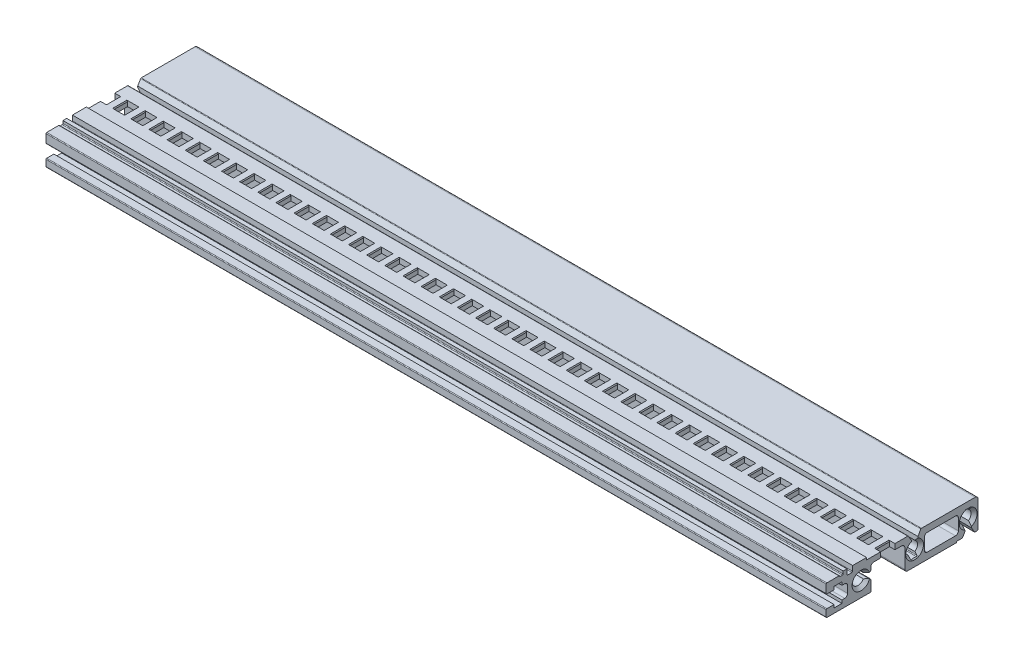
SolidWorks part; units mm, degrees
other "34566584"
ref_plane "前视基准面" through (0, 0, 0) normal (0, 0, 1) x (1, 0, 0)
ref_plane "上视基准面" through (0, 0, 0) normal (0, 1, 0) x (1, 0, 0)
ref_plane "右视基准面" through (0, 0, 0) normal (1, 0, 0) x (0, 0, -1)
imported_body "输入1"
sketch "草图1" plane through (0, 0, 0) normal (0, 1, 0) x (1, 0, 0)
  line L0 (-215.9, 9.4065) -> (-215.9, 24.45) construction
  line L1 (215.9, 41.3252) -> (2.54, 41.3252)
  line L2 (215.9, 41.3252) -> (215.9, -32.8369)
  line L3 (215.9, -32.8369) -> (2.54, -32.8369)
  line L4 (2.54, 41.3252) -> (2.54, -32.8369)
  line L5 (215.9, 24.45) -> (215.9, 9.4065) construction
  dimension "D1" = 218.44
extrude "切除-拉伸1" cut sketch "草图1" against normal mid plane 40
sketch "草图2" plane through (2.54, 0, 0) normal (1, 0, 0) x (0, 0, -1)
  circle A0 centre (-7.5, -4.2) radius 1.65
  circle A1 centre (7.5, -4.2) radius 1.65
  circle A2 centre (22.5, -4.2) radius 1.65
  dimension "D1" = 3.3
extrude "切除-拉伸2" cut sketch "草图2" against normal blind 15.02
chamfer "倒角1" distance 0.85 angle 45 4 edges at (2.54, -4.2, -24.15) (2.54, -4.2, -20.85) (2.54, -4.2, -9.15) (2.54, -4.2, 9.15)
